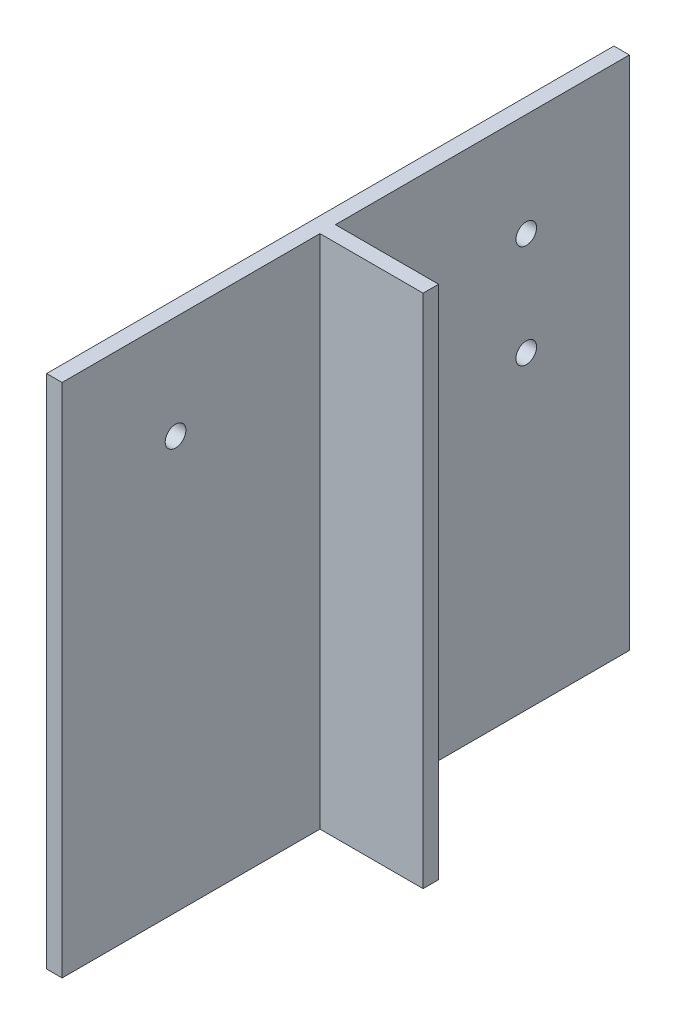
SolidWorks part; units mm, degrees
ref_plane "Front Plane" through (0, 0, 0) normal (0, 0, 1) x (1, 0, 0)
ref_plane "Top Plane" through (0, 0, 0) normal (0, 1, 0) x (1, 0, 0)
ref_plane "Right Plane" through (0, 0, 0) normal (1, 0, 0) x (0, 0, -1)
sketch "Sketch13" plane through (0, 0, 0) normal (1, 0, 0) x (0, 0, -1)
  line L1 (0, 0) -> (1100, 0)
  line L2 (0, 0) -> (0, 1000)
  line L3 (0, 1000) -> (1100, 1000)
  line L4 (1100, 0) -> (1100, 1000)
  dimension "D1" = 1100
  dimension "D2" = 1000
extrude "Extrude2" add sketch "Sketch13" along normal blind 30
sketch "Sketch14" plane through (30, 0, 0) normal (1, 0, 0) x (0, 0, -1)
  line L0 (0, 800) -> (1100, 800) construction
  line L1 (0, 1000) -> (0, 0) construction
  line L2 (1100, 0) -> (1100, 1000) construction
  line L3 (0, 600) -> (1100, 600) construction
  line L4 (900, 1000) -> (900, 0) construction
  line L5 (1100, 1000) -> (0, 1000) construction
  line L6 (0, 0) -> (1100, 0) construction
  line L7 (700, 1000) -> (700, 0) construction
  circle A0 centre (700, 800) radius 20
  circle A1 centre (900, 600) radius 20
  circle A2 centre (900, 800) radius 20
  circle A3 centre (700, 600) radius 20
  dimension "D1" = 40
  dimension "D2" = 200
  dimension "D3" = 200
  dimension "D4" = 400
  dimension "D5" = 200
extrude "Extrude3" cut sketch "Sketch14" against normal through all
sketch "Sketch15" plane through (30, 0, 0) normal (1, 0, 0) x (0, 0, -1)
  line L1 (0, 1000) -> (0, 0) construction
  line L4 (1100, 1000) -> (0, 1000) construction
  circle A0 centre (220, 800) radius 20
  dimension "D1" = 200
  dimension "D2" = 220
  dimension "D3" = 40
extrude "Cut-Extrude1" cut sketch "Sketch15" against normal through all
sketch "Sketch16" plane through (30, 0, 0) normal (1, 0, 0) x (0, 0, -1)
  line L0 (1100, 1000) -> (0, 1000) construction
  line L1 (500, 1000) -> (530, 1000)
  line L2 (500, 1000) -> (500, 0)
  line L3 (500, 0) -> (530, 0)
  line L4 (530, 1000) -> (530, 0)
  line L5 (0, 0) -> (1100, 0) construction
  line L6 (0, 1000) -> (0, 0) construction
  dimension "D1" = 30
  dimension "D2" = 500
extrude "Extrude4" add sketch "Sketch16" along normal blind 200
